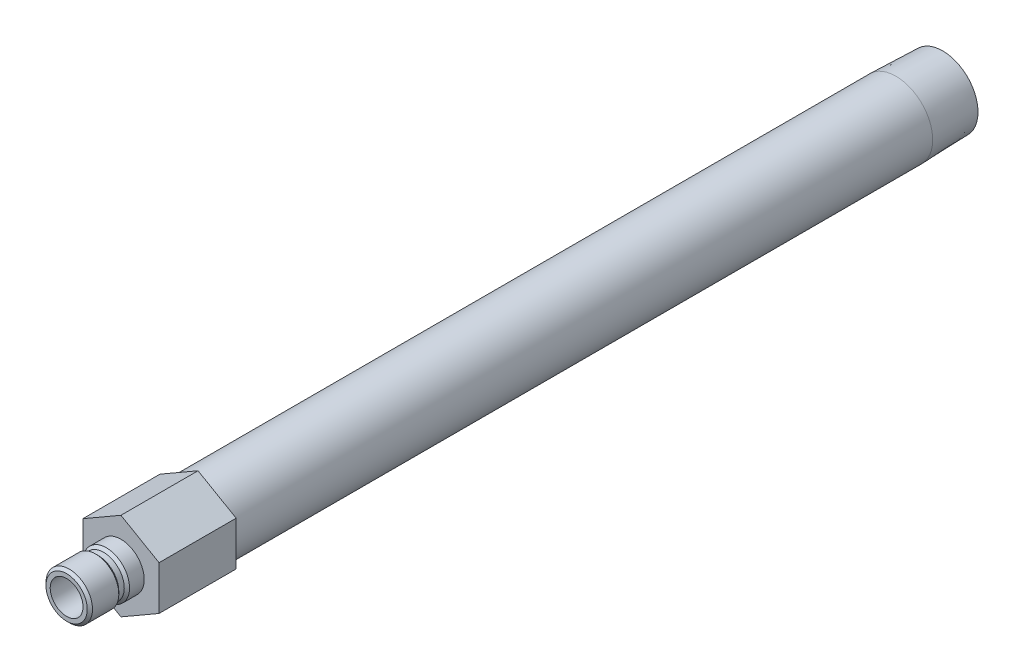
SolidWorks part; units mm, degrees
ref_plane "Front Plane" through (0, 0, 0) normal (0, 0, 1) x (1, 0, 0)
ref_plane "Top Plane" through (0, 0, 0) normal (0, 1, 0) x (1, 0, 0)
ref_plane "Right Plane" through (0, 0, 0) normal (1, 0, 0) x (0, 0, -1)
sketch "Sketch1" plane through (0, 0, 0) normal (1, 0, 0) x (0, 0, -1)
  line L0 (0, 0) -> (-18.923, 0) construction
  line L1 (-15.748, 4.7625) -> (-15.748, 5.9817)
  line L2 (-6.604, 5.9817) -> (-6.604, 0) construction
  line L3 (-14.986, 6.7437) -> (-7.366, 6.7437)
  line L4 (0, 10.668) -> (0, 0) construction
  line L5 (-6.604, 5.9817) -> (-5.0165, 5.9817)
  line L6 (-4.2545, 6.7437) -> (0, 6.7437)
  line L7 (0, 6.7437) -> (0, 10.668)
  line L8 (-6.604, 5.9817) -> (-7.366, 6.7437)
  line L9 (-5.0165, 5.9817) -> (-4.2545, 6.7437)
  line L10 (-15.748, 5.9817) -> (-14.986, 6.7437)
  line L11 (-15.748, 4.7625) -> (22.352, 4.7625)
  line L12 (0, 10.668) -> (224.6884, 10.668)
  line L13 (224.6884, 10.668) -> (238.252, 10.2441)
  line L14 (238.252, 10.2441) -> (238.252, 7.8994)
  line L15 (0, 6.7437) -> (22.352, 6.7437) construction
  line L16 (22.352, 6.7437) -> (22.352, 0) construction
  line L17 (22.352, 0) -> (0, 0) construction
  line L18 (22.352, 4.7625) -> (22.352, 7.8994)
  line L19 (22.352, 7.8994) -> (238.252, 7.8994)
  dimension "D1" = 15.748
  dimension "D2" = 1.5875
  dimension "D3" = 0.762
  dimension "D4" = 45
  dimension "D5" = 9.144
  dimension "D6" = 45
  dimension "D7" = 1.79
  dimension "D8" = 13.5636
  dimension "D9" = 254
  dimension "D10" = 3.175
  dimension "D11" = 9.525
  dimension "D12" = 21.336
  dimension "D13" = 38.1
  dimension "D14" = 13.4874
  dimension "D15" = 15.7988
revolve "Revolve1" add sketch "Sketch1" angle 360 about L0
sketch "Sketch2" plane through (0, 0, 0) normal (0, 0, 1) x (1, 0, 0)
  line L1 (-11.049, 6.3791) -> (-11.049, -6.3791)
  line L2 (-11.049, -6.3791) -> (0, -12.7583)
  line L3 (0, -12.7583) -> (11.049, -6.3791)
  line L4 (11.049, -6.3791) -> (11.049, 6.3791)
  line L5 (11.049, 6.3791) -> (0, 12.7583)
  line L6 (0, 12.7583) -> (-11.049, 6.3791)
  circle A0 centre (0, 0) radius 11.049 construction
  circle A1 centre (0, 0) radius 4.7625 construction
  circle A2 centre (0, 0) radius 4.7625
  dimension "D1" = 22.098
extrude "Boss-Extrude1" add sketch "Sketch2" against normal up to vertex (22.352 mm away) from vertex at 0
